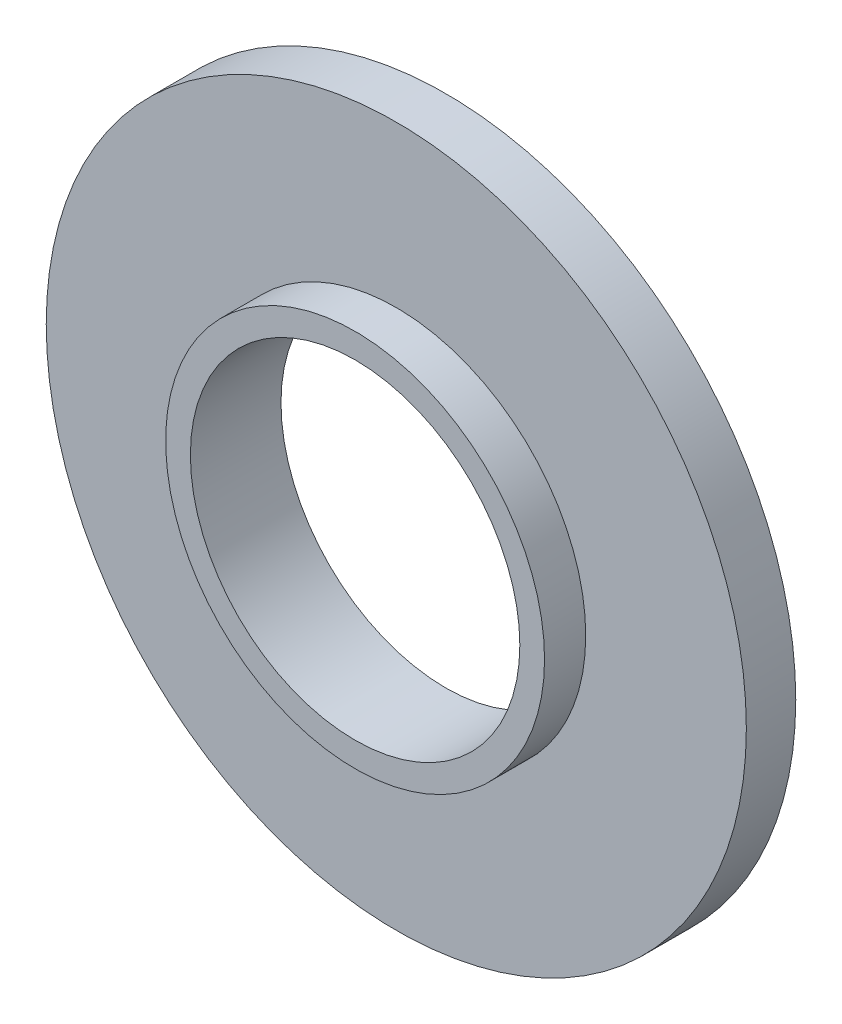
SolidWorks part; units mm, degrees
ref_plane "Front Plane" through (0, 0, 0) normal (0, 0, 1) x (1, 0, 0)
ref_plane "Top Plane" through (0, 0, 0) normal (0, 1, 0) x (1, 0, 0)
ref_plane "Right Plane" through (0, 0, 0) normal (1, 0, 0) x (0, 0, -1)
sketch "Sketch1" plane through (0, 0, 0) normal (0, 0, 1) x (1, 0, 0)
  circle A0 centre (0, 0) radius 8.5
  circle A1 centre (0, 0) radius 4
  dimension "D1" = 8
  dimension "D2" = 17
extrude "Boss-Extrude1" add sketch "Sketch1" along normal blind 1.2
sketch "Sketch2" plane through (0, 0, 1.2) normal (0, 0, 1) x (1, 0, 0)
  circle A0 centre (0, 0) radius 4.6
  circle A1 centre (0, 0) radius 4
  dimension "D1" = 9.2
extrude "Boss-Extrude2" add sketch "Sketch2" along normal blind 1
